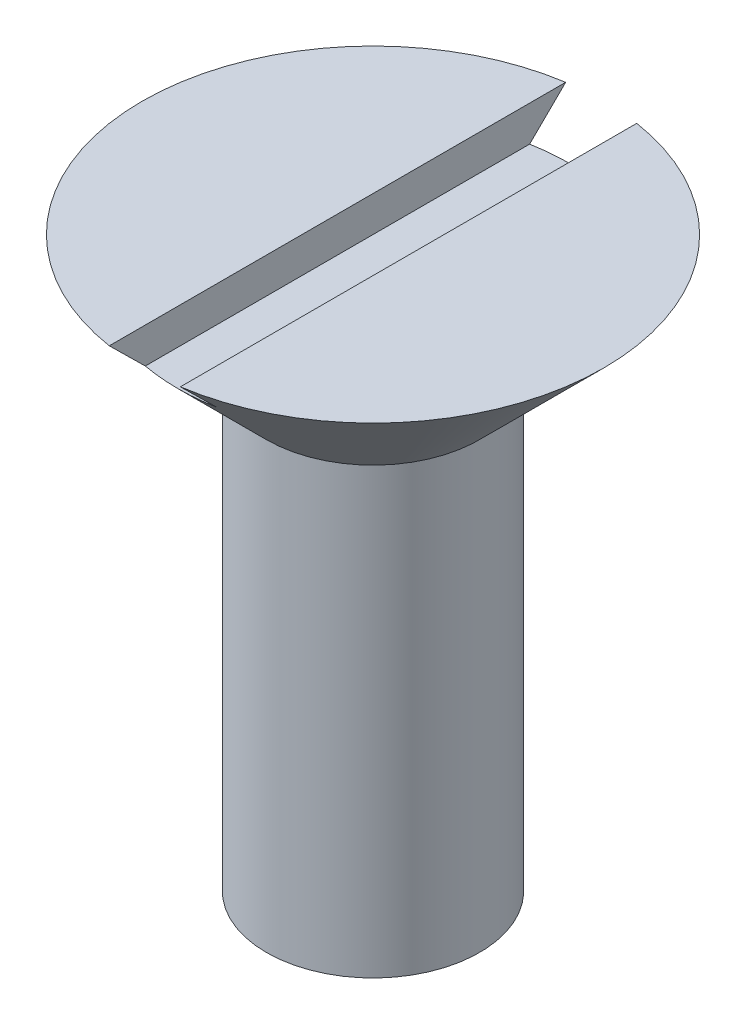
SolidWorks part; units mm, degrees
ref_plane "Front" through (0, 0, 0) normal (0, 0, 1) x (1, 0, 0)
ref_plane "Top" through (0, 0, 0) normal (0, 1, 0) x (1, 0, 0)
ref_plane "Right" through (0, 0, 0) normal (1, 0, 0) x (0, 0, -1)
sketch "Sketch1" plane through (0, 0, 0) normal (0, 0, 1) x (1, 0, 0)
  line L0 (0, 0) -> (0, -30.1094) construction
  line L1 (0, 0) -> (6.5, 0)
  line L2 (6.5, 0) -> (3, -3.5)
  line L3 (3, -3.5) -> (3, -16)
  line L4 (3, -16) -> (0, -17.7321)
  line L5 (0, -17.7321) -> (0, 0)
  dimension "D1" = 6
  dimension "D2" = 60
  dimension "D3" = 12.5
  dimension "D4" = 13
  dimension "D5" = 45
revolve "Revolve1" add sketch "Sketch1" angle 360 about L0
sketch "Sketch2" plane through (0, 0, 0) normal (0, 0, 1) x (1, 0, 0)
  line L0 (6.5, 0) -> (-6.5, 0) construction
  line L1 (-1, 0) -> (1, 0)
  line L2 (-1, 0) -> (-1, -1)
  line L3 (-1, -1) -> (1, -1)
  line L4 (1, 0) -> (1, -1)
  dimension "D1" = 2
  dimension "D2" = 1
extrude "Cut-Extrude1" cut sketch "Sketch2" against normal through all and the other way through all
